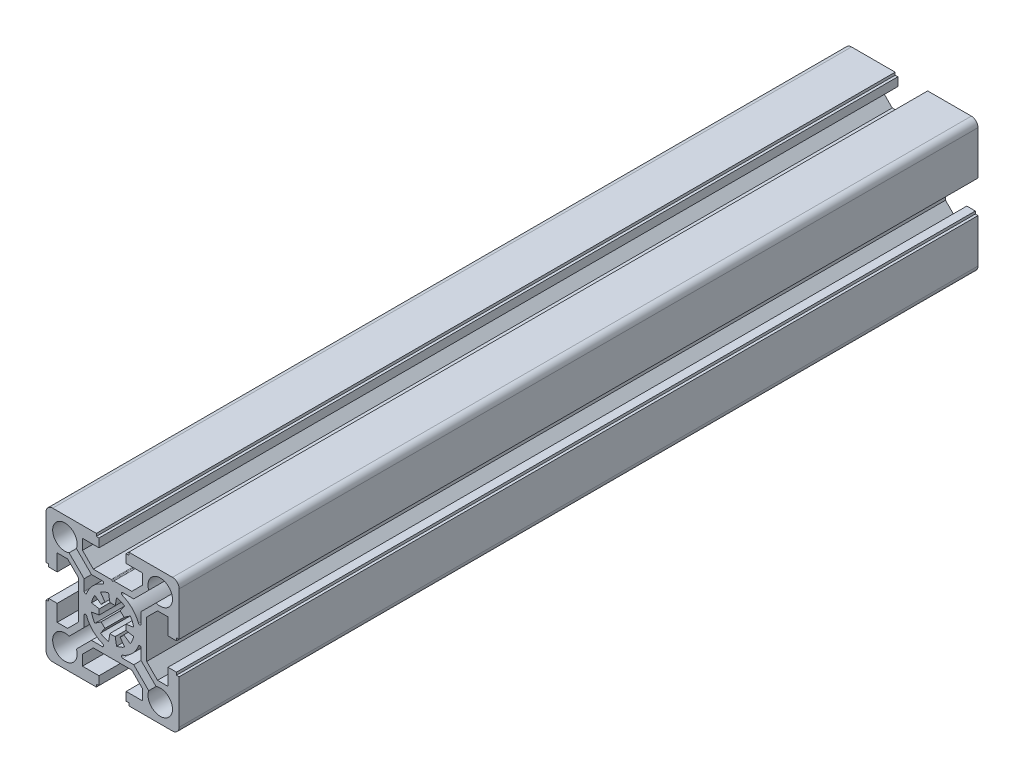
SolidWorks part; units mm, degrees
ref_plane "前视基准面" through (0, 0, 0) normal (0, 0, 1) x (1, 0, 0)
ref_plane "上视基准面" through (0, 0, 0) normal (0, 1, 0) x (1, 0, 0)
ref_plane "右视基准面" through (0, 0, 0) normal (1, 0, 0) x (0, 0, -1)
sketch "Model" plane through (0, 0, 0) normal (0, 0, 1) x (1, 0, 0)
  line L0 (4820.2278, 276.6014) -> (4820.2278, 277.6014)
  line L1 (4820.2278, 277.6014) -> (4817.0278, 277.6014)
  line L2 (4817.0278, 277.6014) -> (4817.0278, 271.4014)
  line L3 (4817.0278, 271.4014) -> (4813.114, 271.4014)
  line L4 (4813.114, 271.4014) -> (4809.0278, 275.4876)
  line L5 (4809.0278, 275.4876) -> (4809.0278, 289.9153)
  line L6 (4809.0278, 289.9153) -> (4813.114, 294.0014)
  line L7 (4813.114, 294.0014) -> (4817.0278, 294.0014)
  line L8 (4817.0278, 294.0014) -> (4817.0278, 287.8014)
  line L9 (4817.0278, 287.8014) -> (4820.2278, 287.8014)
  line L10 (4820.2278, 287.8014) -> (4820.2278, 288.8014)
  line L11 (4820.2278, 288.8014) -> (4821.2278, 288.8014)
  line L12 (4821.2278, 288.8014) -> (4821.2278, 305.2014)
  line L13 (4818.7278, 307.7014) -> (4802.3278, 307.7014)
  line L14 (4802.3278, 307.7014) -> (4802.3278, 306.7014)
  line L15 (4802.3278, 306.7014) -> (4801.3278, 306.7014)
  line L16 (4801.3278, 306.7014) -> (4801.3278, 303.5014)
  line L17 (4801.3278, 303.5014) -> (4807.5278, 303.5014)
  line L18 (4807.5278, 303.5014) -> (4807.5278, 299.5876)
  line L19 (4807.5278, 299.5876) -> (4803.4417, 295.5014)
  line L20 (4803.4417, 295.5014) -> (4796.7474, 295.5014)
  line L21 (4795.7082, 295.5014) -> (4789.014, 295.5014)
  line L22 (4789.014, 295.5014) -> (4784.9278, 299.5876)
  line L23 (4784.9278, 299.5876) -> (4784.9278, 303.5014)
  line L24 (4784.9278, 303.5014) -> (4791.1278, 303.5014)
  line L25 (4791.1278, 303.5014) -> (4791.1278, 306.7014)
  line L26 (4791.1278, 306.7014) -> (4790.1278, 306.7014)
  line L27 (4790.1278, 306.7014) -> (4790.1278, 307.7014)
  line L28 (4790.1278, 307.7014) -> (4773.7278, 307.7014)
  line L29 (4771.2278, 305.2014) -> (4771.2278, 288.8014)
  line L30 (4771.2278, 288.8014) -> (4772.2278, 288.8014)
  line L31 (4772.2278, 288.8014) -> (4772.2278, 287.8014)
  line L32 (4772.2278, 287.8014) -> (4775.4278, 287.8014)
  line L33 (4775.4278, 287.8014) -> (4775.4278, 294.0014)
  line L34 (4775.4278, 294.0014) -> (4779.3417, 294.0014)
  line L35 (4779.3417, 294.0014) -> (4783.4278, 289.9153)
  line L36 (4783.4278, 289.9153) -> (4783.4278, 275.4876)
  line L37 (4783.4278, 275.4876) -> (4779.3417, 271.4014)
  line L38 (4779.3417, 271.4014) -> (4775.4278, 271.4014)
  line L39 (4775.4278, 271.4014) -> (4775.4278, 277.6014)
  line L40 (4775.4278, 277.6014) -> (4772.2278, 277.6014)
  line L41 (4772.2278, 277.6014) -> (4772.2278, 276.6014)
  line L42 (4772.2278, 276.6014) -> (4771.2278, 276.6014)
  line L43 (4771.2278, 276.6014) -> (4771.2278, 260.2014)
  line L44 (4773.7278, 257.7014) -> (4790.1278, 257.7014)
  line L45 (4790.1278, 257.7014) -> (4790.1278, 258.7014)
  line L46 (4790.1278, 258.7014) -> (4791.1278, 258.7014)
  line L47 (4791.1278, 258.7014) -> (4791.1278, 261.9014)
  line L48 (4791.1278, 261.9014) -> (4784.9278, 261.9014)
  line L49 (4784.9278, 261.9014) -> (4784.9278, 265.8153)
  line L50 (4784.9278, 265.8153) -> (4789.014, 269.9014)
  line L51 (4789.014, 269.9014) -> (4803.4417, 269.9014)
  line L52 (4803.4417, 269.9014) -> (4807.5278, 265.8153)
  line L53 (4807.5278, 265.8153) -> (4807.5278, 261.9014)
  line L54 (4807.5278, 261.9014) -> (4801.3278, 261.9014)
  line L55 (4801.3278, 261.9014) -> (4801.3278, 258.7014)
  line L56 (4801.3278, 258.7014) -> (4802.3278, 258.7014)
  line L57 (4802.3278, 258.7014) -> (4802.3278, 257.7014)
  line L58 (4802.3278, 257.7014) -> (4818.7278, 257.7014)
  line L59 (4821.2278, 260.2014) -> (4821.2278, 276.6014)
  line L60 (4821.2278, 276.6014) -> (4820.2278, 276.6014)
  line L61 (4785.5278, 278.8582) -> (4785.5278, 274.7591)
  line L62 (4785.5278, 274.7591) -> (4779.8949, 269.1263)
  line L63 (4782.6526, 266.3685) -> (4788.2855, 272.0014)
  line L64 (4788.2855, 272.0014) -> (4792.3846, 272.0014)
  line L65 (4792.3846, 293.4014) -> (4788.2855, 293.4014)
  line L66 (4788.2855, 293.4014) -> (4782.6526, 299.0343)
  line L67 (4779.8949, 296.2766) -> (4785.5278, 290.6437)
  line L68 (4785.5278, 290.6437) -> (4785.5278, 286.5446)
  line L69 (4797.7278, 290.6104) -> (4797.2278, 287.7024)
  line L70 (4795.2278, 287.7024) -> (4794.7278, 290.6104)
  line L71 (4791.696, 289.3546) -> (4793.3987, 286.9448)
  line L72 (4791.9845, 285.5306) -> (4789.5746, 287.2333)
  line L73 (4788.3188, 284.2014) -> (4791.2268, 283.7014)
  line L74 (4791.2268, 281.7014) -> (4788.3188, 281.2014)
  line L75 (4789.5746, 278.1696) -> (4791.9845, 279.8723)
  line L76 (4793.3987, 278.4581) -> (4791.696, 276.0482)
  line L77 (4794.7278, 274.7924) -> (4795.2278, 277.7004)
  line L78 (4797.2278, 277.7004) -> (4797.7278, 274.7924)
  line L79 (4800.7597, 276.0482) -> (4799.057, 278.4581)
  line L80 (4800.4712, 279.8723) -> (4802.881, 278.1696)
  line L81 (4804.1368, 281.2014) -> (4801.2288, 281.7014)
  line L82 (4801.2288, 283.7014) -> (4804.1368, 284.2014)
  line L83 (4802.881, 287.2333) -> (4800.4712, 285.5306)
  line L84 (4799.057, 286.9448) -> (4800.7597, 289.3546)
  line L85 (4800.071, 272.0014) -> (4804.1701, 272.0014)
  line L86 (4804.1701, 272.0014) -> (4809.803, 266.3685)
  line L87 (4812.5607, 269.1263) -> (4806.9278, 274.7591)
  line L88 (4806.9278, 274.7591) -> (4806.9278, 278.8582)
  line L89 (4804.1701, 293.4014) -> (4800.071, 293.4014)
  line L90 (4806.9278, 286.5446) -> (4806.9278, 290.6437)
  line L91 (4806.9278, 290.6437) -> (4812.5607, 296.2766)
  line L92 (4809.803, 299.0343) -> (4804.1701, 293.4014)
  arc A0 (4821.2278, 305.2014) -> (4818.7278, 307.7014) centre (4818.7278, 305.2014) ccw
  arc A1 (4796.7474, 295.5014) -> (4796.4876, 295.3514) centre (4796.7474, 295.2014) ccw
  arc A2 (4795.968, 295.3514) -> (4796.4876, 295.3514) centre (4796.2278, 295.5014) ccw
  arc A3 (4795.968, 295.3514) -> (4795.7082, 295.5014) centre (4795.7082, 295.2014) ccw
  arc A4 (4773.7278, 307.7014) -> (4771.2278, 305.2014) centre (4773.7278, 305.2014) ccw
  arc A5 (4771.2278, 260.2014) -> (4773.7278, 257.7014) centre (4773.7278, 260.2014) ccw
  arc A6 (4818.7278, 257.7014) -> (4821.2278, 260.2014) centre (4818.7278, 260.2014) ccw
  arc A7 (4792.3846, 272.0014) -> (4792.5609, 272.9693) centre (4792.3846, 272.5014) ccw
  arc A8 (4786.4957, 279.0345) -> (4792.5609, 272.9693) centre (4796.2278, 282.7014) ccw
  arc A9 (4786.4957, 279.0345) -> (4785.5278, 278.8582) centre (4786.0278, 278.8582) ccw
  arc A10 (4779.8949, 269.1263) -> (4782.6526, 266.3685) centre (4778.3278, 264.8014) ccw
  arc A11 (4792.5609, 292.4335) -> (4786.4957, 286.3683) centre (4796.2278, 282.7014) ccw
  arc A12 (4792.5609, 292.4335) -> (4792.3846, 293.4014) centre (4792.3846, 292.9014) ccw
  arc A13 (4782.6526, 299.0343) -> (4779.8949, 296.2766) centre (4778.3278, 300.6014) ccw
  arc A14 (4785.5278, 286.5446) -> (4786.4957, 286.3683) centre (4786.0278, 286.5446) ccw
  arc A15 (4800.7597, 289.3546) -> (4797.7278, 290.6104) centre (4796.2278, 282.7014) ccw
  arc A16 (4797.2278, 287.7024) -> (4795.2278, 287.7024) centre (4796.2278, 282.7014) ccw
  arc A17 (4794.7278, 290.6104) -> (4791.696, 289.3546) centre (4796.2278, 282.7014) ccw
  arc A18 (4793.3987, 286.9448) -> (4791.9845, 285.5306) centre (4796.2278, 282.7014) ccw
  arc A19 (4789.5746, 287.2333) -> (4788.3188, 284.2014) centre (4796.2278, 282.7014) ccw
  arc A20 (4791.2268, 283.7014) -> (4791.2268, 281.7014) centre (4796.2278, 282.7014) ccw
  arc A21 (4788.3188, 281.2014) -> (4789.5746, 278.1696) centre (4796.2278, 282.7014) ccw
  arc A22 (4791.9845, 279.8723) -> (4793.3987, 278.4581) centre (4796.2278, 282.7014) ccw
  arc A23 (4791.696, 276.0482) -> (4794.7278, 274.7924) centre (4796.2278, 282.7014) ccw
  arc A24 (4795.2278, 277.7004) -> (4797.2278, 277.7004) centre (4796.2278, 282.7014) ccw
  arc A25 (4797.7278, 274.7924) -> (4800.7597, 276.0482) centre (4796.2278, 282.7014) ccw
  arc A26 (4799.057, 278.4581) -> (4800.4712, 279.8723) centre (4796.2278, 282.7014) ccw
  arc A27 (4802.881, 278.1696) -> (4804.1368, 281.2014) centre (4796.2278, 282.7014) ccw
  arc A28 (4801.2288, 281.7014) -> (4801.2288, 283.7014) centre (4796.2278, 282.7014) ccw
  arc A29 (4804.1368, 284.2014) -> (4802.881, 287.2333) centre (4796.2278, 282.7014) ccw
  arc A30 (4800.4712, 285.5306) -> (4799.057, 286.9448) centre (4796.2278, 282.7014) ccw
  arc A31 (4809.803, 266.3685) -> (4812.5607, 269.1263) centre (4814.1278, 264.8014) ccw
  arc A32 (4806.9278, 278.8582) -> (4805.9599, 279.0345) centre (4806.4278, 278.8582) ccw
  arc A33 (4799.8947, 272.9693) -> (4805.9599, 279.0345) centre (4796.2278, 282.7014) ccw
  arc A34 (4799.8947, 272.9693) -> (4800.071, 272.0014) centre (4800.071, 272.5014) ccw
  arc A35 (4800.071, 293.4014) -> (4799.8947, 292.4335) centre (4800.071, 292.9014) ccw
  arc A36 (4805.9599, 286.3683) -> (4799.8947, 292.4335) centre (4796.2278, 282.7014) ccw
  arc A37 (4805.9599, 286.3683) -> (4806.9278, 286.5446) centre (4806.4278, 286.5446) ccw
  arc A38 (4812.5607, 296.2766) -> (4809.803, 299.0343) centre (4814.1278, 300.6014) ccw
  arc A39 (4802.4875, 277.6399) -> (4801.2893, 288.9611) centre (4796.2278, 282.7014) ccw construction
  arc A40 (4798.9054, 278.3608) -> (4800.5684, 285.379) centre (4796.2278, 282.7014) ccw construction
  point P152 (4801.3278, 306.7014)
  point P153 (4790.1278, 307.7014)
  dimension "D5" = 9.2
  dimension "D10" = 16.1
  dimension "D11" = 10.2
  dimension "D1" = 50
  dimension "D2" = 50
  dimension "D3" = 10.2
  dimension "D4" = 8
  dimension "D6" = 4.2
  dimension "D7" = 12.2
  dimension "D8" = 35.8
  dimension "D9" = 22.6
extrude "凸台-拉伸1" add sketch "Model" along normal blind 300
